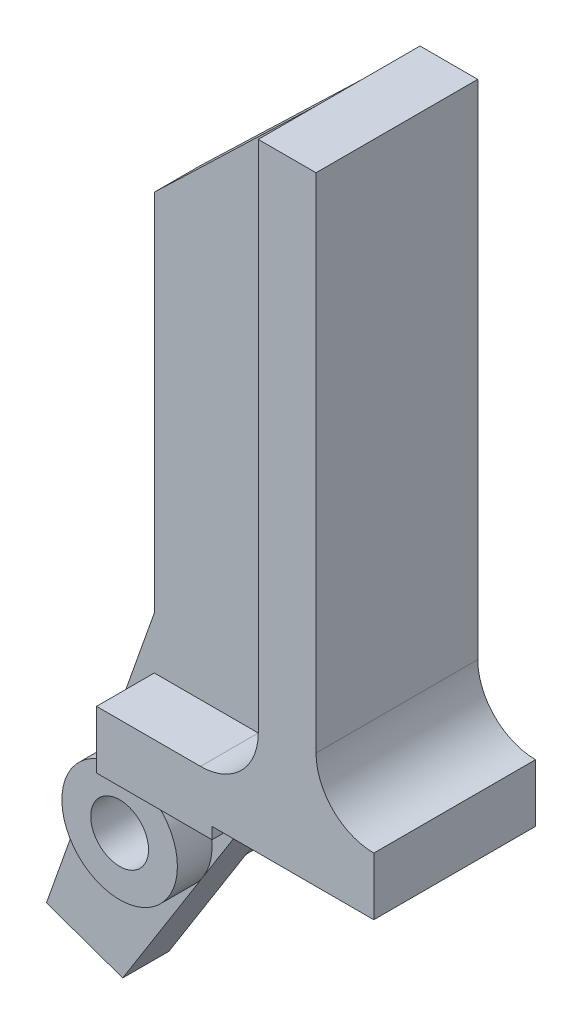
SolidWorks part; units mm, degrees
ref_plane "plan médian" through (0, 0, 0) normal (0, 0, 1) x (1, 0, 0)
ref_plane "Plan2" through (0, 0, 0) normal (0, 1, 0) x (1, 0, 0)
ref_plane "Plan3" through (0, 0, 0) normal (1, 0, 0) x (0, 0, -1)
sketch "Esquisse1" plane through (0, 0, 0) normal (0, 0, 1) x (1, 0, 0)
  circle A0 centre (0, 0) radius 1.25
  circle A1 centre (0, 0) radius 2.5
  dimension "D1" = 2.5
  dimension "D2" = 5
extrude "Base-Extrusion" add sketch "Esquisse1" along normal mid plane 5
sketch "Esquisse2" plane through (0, 0, 0) normal (0, 0, 1) x (1, 0, 0)
  line L0 (0, 7.5) -> (0, 23.271)
  line L1 (0, 23.271) -> (7, 30)
  line L3 (7, 30) -> (7, 6.4299)
  line L4 (-6, 0) -> (7, 0) construction
  line L5 (-4.6667, -5.6993) -> (0, 7.5)
  line L6 (-4.6667, -5.6993) -> (-1.3668, -6.866)
  line L7 (-1.3668, -6.866) -> (7, 6.4299)
  line L8 (-10, 30) -> (15, 30) construction
  circle A0 centre (0, 0) radius 2.5 construction
  circle A1 centre (0, 0) radius 1.25 construction
  circle A2 centre (0, 0) radius 1.25
  arc A3 (2.6295, 26.6599) -> (4.4303, 27.6247) centre (2.7179, 28.6579) ccw construction
  dimension "D1" = 7
  dimension "D2" = 30
  dimension "D5" = 7.5
  dimension "D6" = 14
  dimension "D7" = 3.5
extrude "Boss.-Extru.1" add sketch "Esquisse2" along normal mid plane 2
sketch "Esquisse4" plane through (0, 0, 0) normal (0, 0, 1) x (1, 0, 0)
  line L0 (7, 6.4299) -> (7, 30) construction
  line L1 (7, 7.75) -> (7, 30)
  line L2 (4.999, 3.25) -> (12, 3.25)
  line L3 (4.999, 3.25) -> (4.999, 2.75)
  line L4 (9.5, 8.25) -> (9.5, 30)
  line L5 (0, 2.75) -> (4.999, 2.75)
  line L6 (0, 5.25) -> (4.5, 5.25)
  line L7 (0, 23.271) -> (0, 7.5) construction
  line L8 (0, 5.25) -> (0, 2.75)
  line L9 (2.1159, -1.3315) -> (7, 6.4299) construction
  line L10 (12, 3.25) -> (12, 5.75)
  line L11 (7, 30) -> (9.5, 30)
  arc A1 (9.5, 8.25) -> (12, 5.75) centre (12, 8.25) ccw
  arc A2 (7, 7.75) -> (4.5, 5.25) centre (4.5, 7.75) cw
  dimension "D6" = 5
  dimension "D8" = 2.5
  dimension "D5" = 2.5
  dimension "D7" = 2.75
  dimension "D1" = 2.5
  dimension "D2" = 2.5
  dimension "D3" = 0.5
  dimension "D4" = 2.5
extrude "Boss.-Extru.3" add sketch "Esquisse4" along normal mid plane 7
